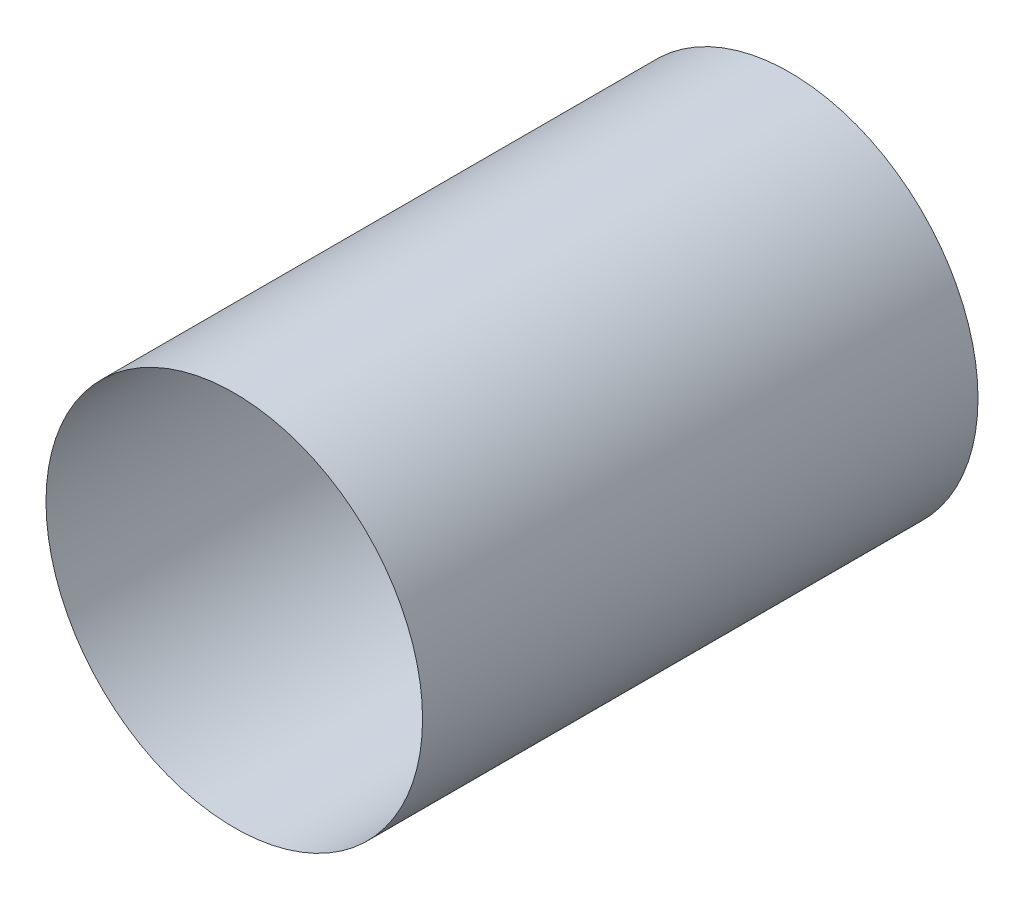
SolidWorks part; units mm, degrees
ref_plane "Front Plane" through (0, 0, 0) normal (0, 0, 1) x (1, 0, 0)
ref_plane "Top Plane" through (0, 0, 0) normal (0, 1, 0) x (1, 0, 0)
ref_plane "Right Plane" through (0, 0, 0) normal (1, 0, 0) x (0, 0, -1)
sketch "Sketch10" plane through (0, 0, 0) normal (0, 0, 1) x (1, 0, 0)
  circle A0 centre (0, -31.75) radius 101.6
  dimension "D1" = 203.2
  dimension "D3" = 31.75
surface "Surface-Extrude1" sketch "Sketch10" parameters "D1"=299.72
